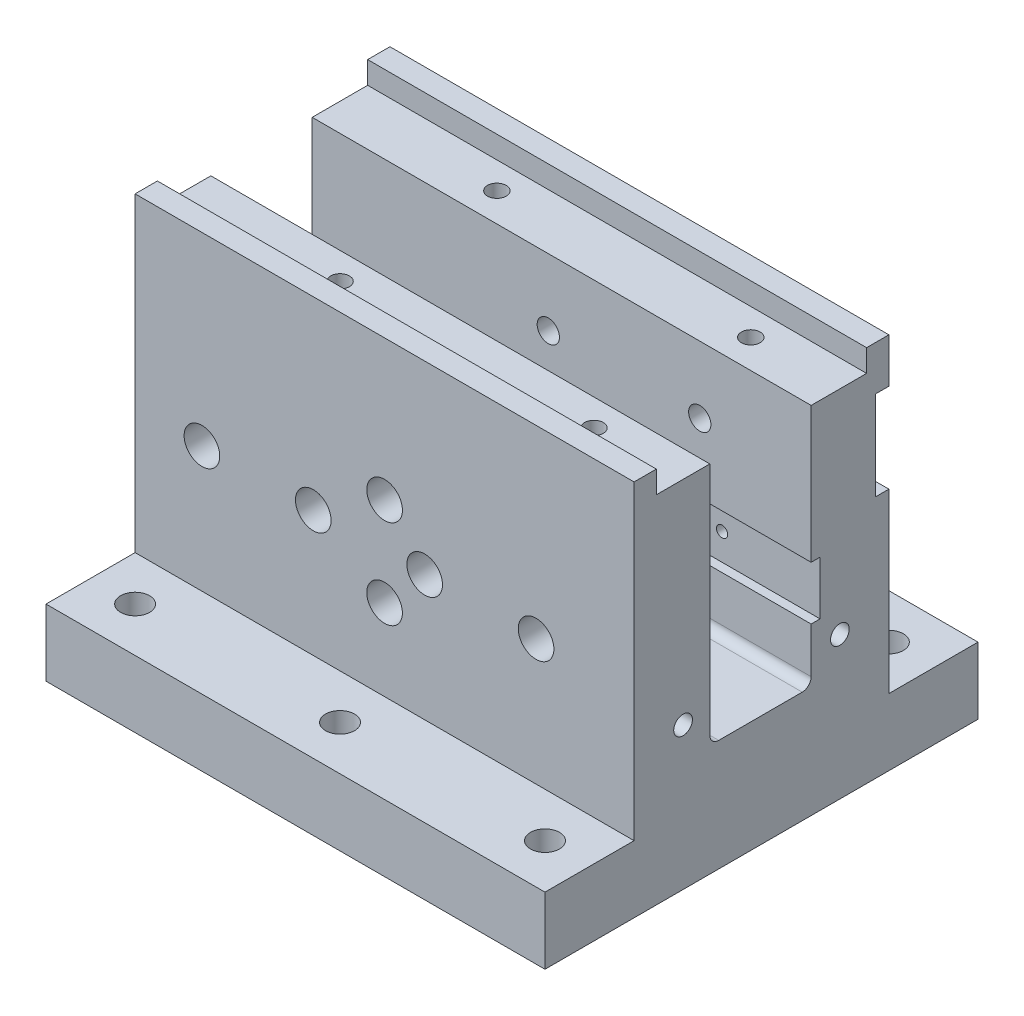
SolidWorks part; units mm, degrees
ref_plane "前视基准面" through (0, 0, 0) normal (0, 0, 1) x (1, 0, 0)
ref_plane "上视基准面" through (0, 0, 0) normal (0, 1, 0) x (1, 0, 0)
ref_plane "右视基准面" through (0, 0, 0) normal (1, 0, 0) x (0, 0, -1)
sketch "草图1" plane through (0, 0, 0) normal (0, 0, 1) x (1, 0, 0)
  line L0 (0, 0) -> (112, 0)
  line L1 (0, 84.74) -> (112, 84.74)
  line L2 (112, 0) -> (112, 84.74)
  line L3 (0, 0) -> (0, 84.74)
extrude "凸台-拉伸1" add sketch "草图1" along normal blind 97.2
sketch "草图3" plane through (112, 0, 0) normal (1, 0, 0) x (0, 0, -1)
  line L0 (-72.2, 79.74) -> (-72.2, 84.74)
  line L1 (-25, 79.74) -> (-25, 84.74)
  line L2 (-37.45, 27) -> (-37.45, 37.24)
  line L3 (-72.2, 79.74) -> (-60.2, 79.74)
  line L4 (-77.2, 15) -> (-77.2, 84.74)
  line L5 (-20, 15) -> (-20, 54.74)
  line L6 (-97.2, 0) -> (0, 0)
  line L7 (0, 0) -> (0, 15)
  line L8 (-97.2, 0) -> (-97.2, 15)
  line L9 (-97.2, 15) -> (-77.2, 15)
  line L10 (-77.2, 84.74) -> (-72.2, 84.74)
  line L11 (-60.2, 27) -> (-60.2, 79.74)
  line L12 (-25, 84.74) -> (-20, 84.74)
  line L13 (-37.45, 79.74) -> (-25, 79.74)
  line L14 (-58.2, 25) -> (-39.45, 25)
  line L15 (-20, 15) -> (0, 15)
  line L16 (-37.45, 49.24) -> (-35.45, 49.24)
  line L17 (-37.45, 37.24) -> (-35.45, 37.24)
  line L18 (-35.45, 37.24) -> (-35.45, 49.24)
  line L19 (-37.45, 49.24) -> (-37.45, 79.74)
  line L20 (-23, 74.74) -> (-20, 74.74)
  line L21 (-23, 54.74) -> (-20, 54.74)
  line L22 (-23, 54.74) -> (-23, 74.74)
  line L23 (-20, 74.74) -> (-20, 84.74)
  arc A0 (-60.2, 27) -> (-58.2, 25) centre (-58.2, 27) ccw
  arc A1 (-39.45, 25) -> (-37.45, 27) centre (-39.45, 27) ccw
extrude "切除-拉伸1" cut sketch "草图3" against normal through all flip side to cut
sketch "草图4" plane through (0, 0, 77.2) normal (0, 0, 1) x (1, 0, 0)
  circle A0 centre (15, 43.24) radius 4
  circle A1 centre (40, 43.24) radius 4
  circle A2 centre (65, 43.24) radius 4
  circle A3 centre (90, 43.24) radius 4
  circle A4 centre (56, 53.24) radius 4
  circle A5 centre (56, 33.24) radius 4
extrude "切除-拉伸2" cut sketch "草图4" against normal blind 20
sketch "草图5" plane through (0, 0, 35.45) normal (0, 0, 1) x (1, 0, 0)
  circle A0 centre (40, 43.24) radius 1.25
  circle A1 centre (15, 43.24) radius 1.25
  circle A2 centre (65, 43.24) radius 1.25
  circle A3 centre (90, 43.24) radius 1.25
extrude "切除-拉伸3" cut sketch "草图5" against normal blind 20
sketch "草图6" plane through (0, 0, 77.2) normal (0, 0, 1) x (1, 0, 0)
  circle A0 centre (87, 64.74) radius 2.5 construction
  circle A1 centre (53, 64.74) radius 2.5 construction
sketch "草图7" plane through (0, 0, 23) normal (0, 0, -1) x (-1, 0, 0)
  circle A0 centre (-87, 64.74) radius 2.5
  circle A1 centre (-53, 64.74) radius 2.5
extrude "切除-拉伸4" cut sketch "草图7" against normal blind 20
sketch "草图8" plane through (0, 15, 0) normal (0, 1, 0) x (1, 0, 0)
  circle A0 centre (10, -10) radius 3.25
  circle A1 centre (56, -10) radius 3.25
  circle A2 centre (102, -10) radius 3.25
  circle A3 centre (102, -87.2) radius 3.25
  circle A4 centre (56, -87.2) radius 3.25
  circle A5 centre (10, -87.2) radius 3.25
extrude "切除-拉伸5" cut sketch "草图8" against normal blind 20
sketch "草图9" plane through (0, 79.74, 0) normal (0, 1, 0) x (1, 0, 0)
  circle A0 centre (35, -31) radius 2.1
  circle A1 centre (92, -31) radius 2.1
  circle A2 centre (92, -66.2) radius 2.1
  circle A3 centre (35, -66.2) radius 2.1
extrude "切除-拉伸6" cut sketch "草图9" against normal blind 20
sketch "草图10" plane through (112, 0, 0) normal (1, 0, 0) x (0, 0, -1)
  circle A0 centre (-66.2, 32) radius 2.1
  circle A1 centre (-31, 32) radius 2.1
extrude "切除-拉伸7" cut sketch "草图10" against normal blind 10
